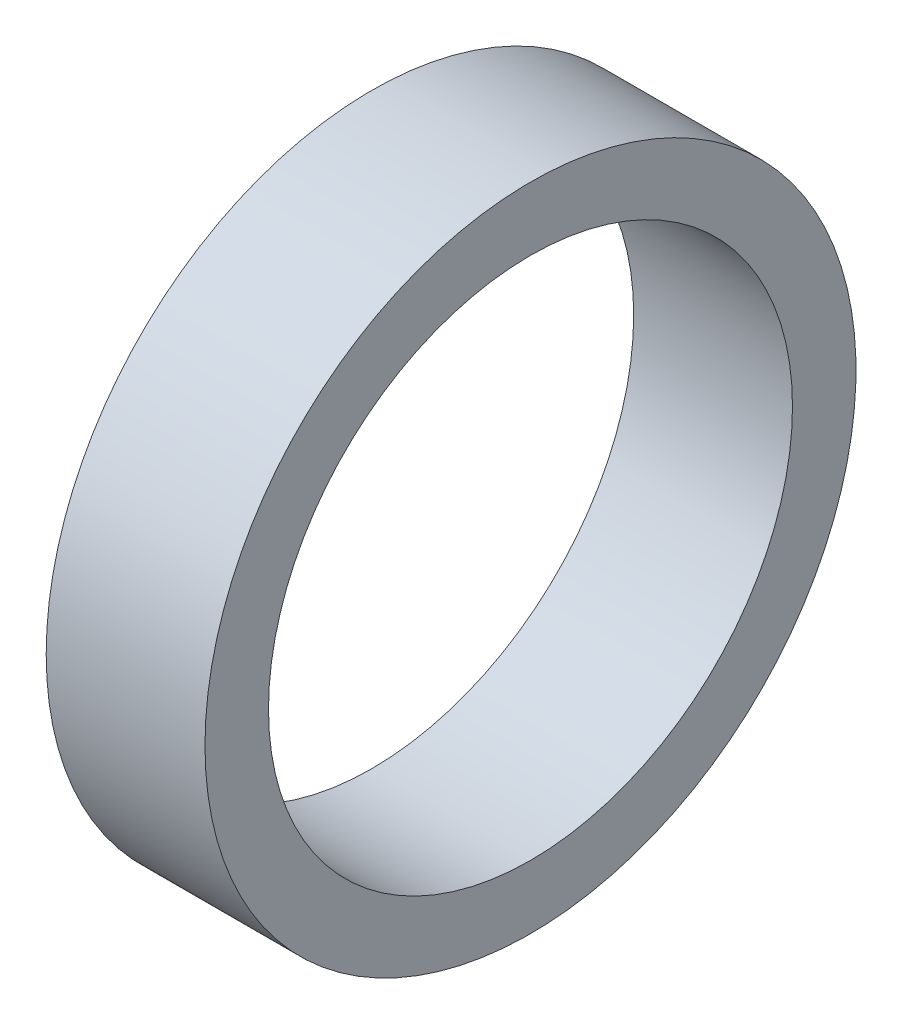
SolidWorks part; units mm, degrees
ref_plane "Plan de face" through (0, 0, 0) normal (0, 0, 1) x (1, 0, 0)
ref_plane "Plan de dessus" through (0, 0, 0) normal (0, 1, 0) x (1, 0, 0)
ref_plane "Plan de droite" through (0, 0, 0) normal (1, 0, 0) x (0, 0, -1)
sketch "Esquisse1" plane through (0, 0, 0) normal (0, 0, 1) x (1, 0, 0)
  line L0 (-14.904, 0) -> (13.8005, 0) construction
  line L1 (-5, 20.5) -> (5, 20.5)
  line L2 (-5, 20.5) -> (-5, 16.5)
  line L3 (-5, 16.5) -> (5, 16.5)
  line L4 (5, 20.5) -> (5, 16.5)
  dimension "D1" = 4
  dimension "D2" = 10
  dimension "D3" = 5
  dimension "D4" = 16.5
revolve "Révolution1" add sketch "Esquisse1" angle 360 about L0
